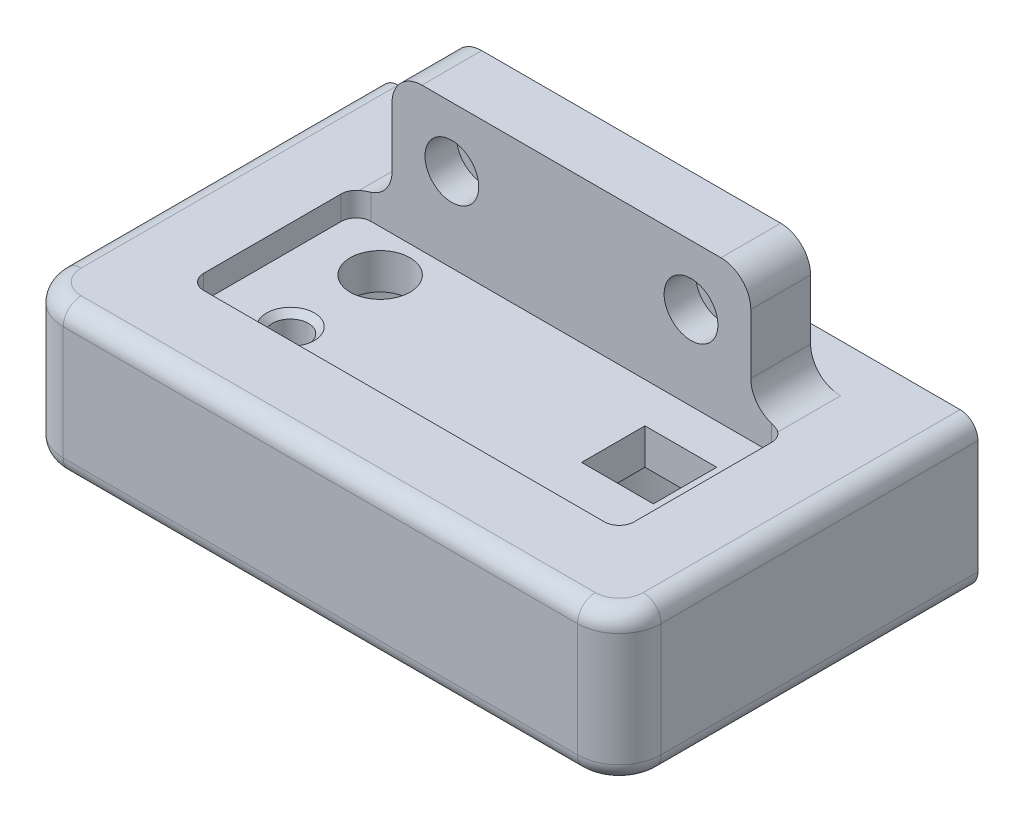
SolidWorks part; units mm, degrees
ref_plane "Front Plane" through (0, 0, 0) normal (0, 0, 1) x (1, 0, 0)
ref_plane "Top Plane" through (0, 0, 0) normal (0, 1, 0) x (1, 0, 0)
ref_plane "Right Plane" through (0, 0, 0) normal (1, 0, 0) x (0, 0, -1)
sketch "Sketch1" plane through (0, 0, 0) normal (0, 0, 1) x (1, 0, 0)
  line L1 (0, 0) -> (100, 0)
  line L2 (0, 0) -> (0, 25)
  line L3 (0, 25) -> (100, 25)
  line L4 (100, 0) -> (100, 25)
  dimension "D1" = 25
  dimension "D2" = 100
extrude "Boss-Extrude1" add sketch "Sketch1" along normal blind 60
sketch "Sketch5" plane through (0, 25, 0) normal (0, 1, 0) x (1, 0, 0)
  line L0 (0, -60) -> (0, 0) construction
  line L1 (20, -8) -> (80, -8)
  line L2 (20, -8) -> (20, -18)
  line L3 (20, -18) -> (80, -18)
  line L4 (80, -8) -> (80, -18)
  line L5 (100, 0) -> (0, 0) construction
  dimension "D1" = 60
  dimension "D2" = 10
  dimension "D3" = 20
  dimension "D4" = 8
extrude "Boss-Extrude2" add sketch "Sketch5" along normal blind 20
sketch "Sketch6" plane through (0, 0, 8) normal (0, 0, -1) x (-1, 0, 0)
  line L0 (-80, 25) -> (-20, 25) construction
  line L1 (-80, 45) -> (-80, 25) construction
  circle A0 centre (-70, 35) radius 3
  circle A1 centre (-30, 35) radius 3
  dimension "D1" = 6
  dimension "D2" = 40
  dimension "D3" = 10
  dimension "D4" = 10
  dimension "D5" = 10
extrude "Cut-Extrude2" cut sketch "Sketch6" against normal blind 10
sketch "Sketch7" plane through (0, 0, 0) normal (0, -1, 0) x (1, 0, 0)
  line L0 (0, 60) -> (0, 53)
  line L1 (0, 60) -> (0, 0) construction
  line L2 (0, 60) -> (7, 60)
  line L3 (0, 60) -> (100, 60) construction
  line L4 (100, 60) -> (93, 60)
  line L5 (100, 60) -> (100, 53)
  line L6 (100, 60) -> (100, 0) construction
  arc A0 (0, 53) -> (7, 60) centre (7, 53) cw
  arc A1 (93, 60) -> (100, 53) centre (93, 53) cw
  dimension "D1" = 7
  dimension "D2" = 7
  dimension "D3" = 7
  dimension "D4" = 7
extrude "Cut-Extrude3" cut sketch "Sketch7" against normal through all
fillet "Fillet1" radius 3 10 edges at (100, 25, 26.5) (97.9497, 25, 57.9497) (50, 25, 60) (2.0503, 25, 57.9497) (0, 25, 26.5) (2.0503, 0, 57.9497) (0, 0, 26.5) (97.9497, 0, 57.9497) (50, 0, 60) (100, 0, 26.5)
sketch "Sketch8" plane through (0, 0, 0) normal (0, -1, 0) x (1, 0, 0)
  line L0 (0, 0) -> (0, 53) construction
  line L1 (100, 53) -> (100, 0) construction
  line L2 (3, 0) -> (97, 0) construction
  circle A0 centre (25, 30) radius 20
  circle A1 centre (75, 30) radius 20
  dimension "D1" = 40
  dimension "D2" = 40
  dimension "D3" = 25
  dimension "D4" = 25
  dimension "D5" = 30
  dimension "D6" = 30
extrude "Cut-Extrude4" cut sketch "Sketch8" against normal blind 15
sketch "Sketch9" plane through (0, 0, 18) normal (0, 0, 1) x (1, 0, 0)
  circle A0 centre (30, 35) radius 4.5
  circle A1 centre (70, 35) radius 4.5
  dimension "D1" = 9
  dimension "D2" = 9
extrude "Cut-Extrude5" cut sketch "Sketch9" against normal blind 5.3
sketch "Sketch10" plane through (0, 15, 0) normal (0, -1, 0) x (1, 0, 0)
  line L0 (0, 0) -> (0, 53) construction
  line L2 (3, 0) -> (97, 0) construction
  line L5 (69, 24.7) -> (81, 24.7)
  line L6 (69, 24.7) -> (69, 35.3)
  line L7 (69, 35.3) -> (81, 35.3)
  line L8 (81, 24.7) -> (81, 35.3)
  line L9 (69, 24.7) -> (81, 35.3) construction
  line L10 (69, 35.3) -> (81, 24.7) construction
  circle A3 centre (25, 25) radius 5
  circle A6 centre (25, 40) radius 3
  point P2 (75, 30)
  dimension "D1" = 15
  dimension "D4" = 25
  dimension "D2" = 10
  dimension "D3" = 6
  dimension "D5" = 12
  dimension "D6" = 10.6
  dimension "D7" = 25
  dimension "D8" = 25
extrude "Cut-Extrude6" cut sketch "Sketch10" against normal blind 10
sketch "Sketch11" plane through (0, 25, 0) normal (0, 1, 0) x (1, 0, 0)
  line L0 (20, -18) -> (80, -18) construction
  line L1 (16.5, -46) -> (83.5, -46)
  line L2 (14, -43.5) -> (14, -20.5)
  line L3 (16.5, -18) -> (83.5, -18)
  line L4 (86, -43.5) -> (86, -20.5)
  line L5 (100, 0) -> (100, -53) construction
  arc A0 (83.5, -46) -> (86, -43.5) centre (83.5, -43.5) ccw
  arc A1 (16.5, -46) -> (14, -43.5) centre (16.5, -43.5) cw
  arc A2 (83.5, -18) -> (86, -20.5) centre (83.5, -20.5) cw
  arc A3 (14, -20.5) -> (16.5, -18) centre (16.5, -20.5) cw
  point P13 (14, -46)
  point P18 (14, -18)
  dimension "D5" = 2.5
  dimension "D1" = 0
  dimension "D2" = 28
  dimension "D3" = 14
  dimension "D4" = 14
extrude "Cut-Extrude7" cut sketch "Sketch11" against normal blind 4
chamfer "Chamfer2" distance 1 angle 45 1 edges at (25, 21, 43)
fillet "Redondeo1" radius 5 4 edges at (20, 25, 13) (20, 45, 13) (80, 45, 13) (80, 25, 13)
